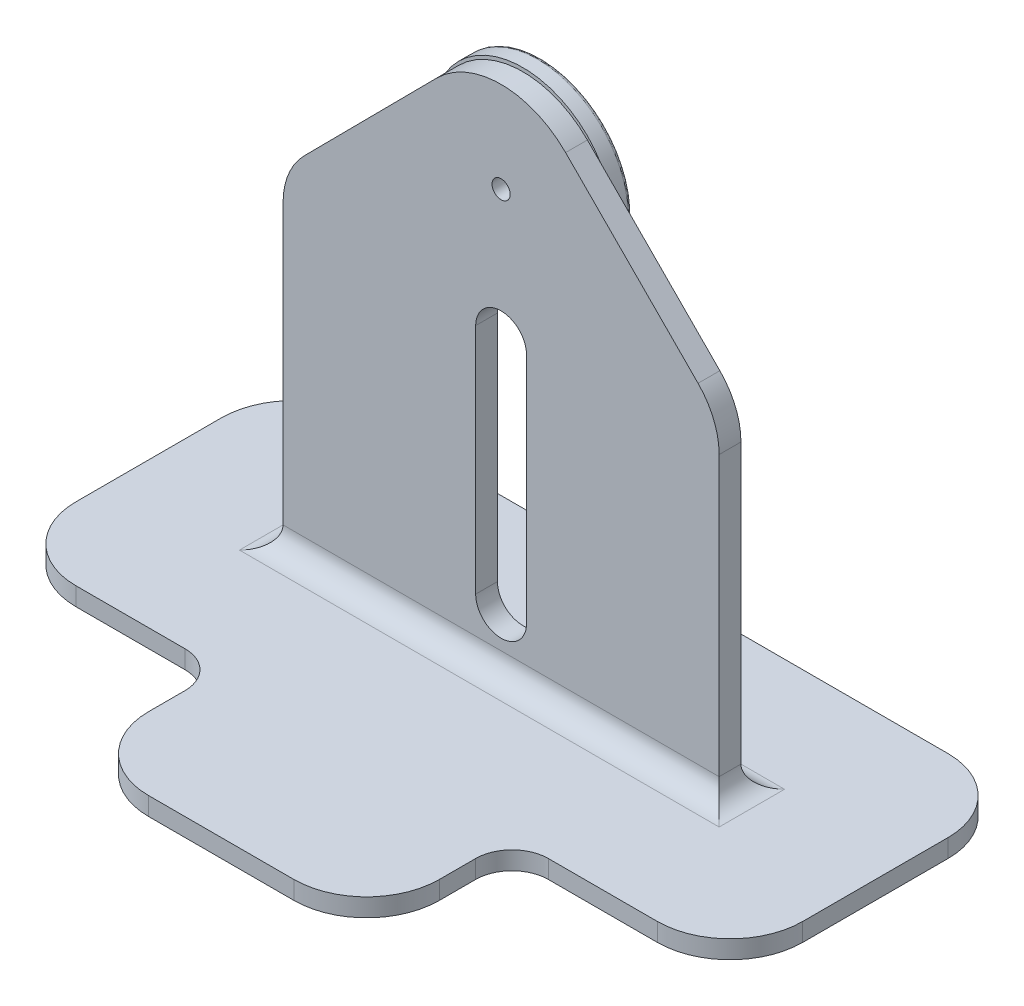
SolidWorks part; units mm, degrees
ref_plane "Plan de face" through (0, 0, 0) normal (0, 0, 1) x (1, 0, 0)
ref_plane "Plan de dessus" through (0, 0, 0) normal (0, 1, 0) x (1, 0, 0)
ref_plane "Plan de droite" through (0, 0, 0) normal (1, 0, 0) x (0, 0, -1)
sketch "Esquisse1" plane through (0, 0, 0) normal (0, 1, 0) x (1, 0, 0)
  line L0 (60, 40) -> (60, 0) construction
  line L1 (85, 0) -> (100, 0)
  line L2 (10, 10) -> (10, 30)
  line L3 (110, 20) -> (10, 20) construction
  line L4 (110, 10) -> (110, 30)
  line L5 (35, 0) -> (20, 0)
  line L7 (40, -5) -> (40, -10)
  line L8 (50, -20) -> (70, -20)
  line L9 (80, -5) -> (80, -10)
  line L10 (20, 40) -> (100, 40)
  arc A0 (20, 40) -> (10, 30) centre (20, 30) ccw
  arc A1 (110, 30) -> (100, 40) centre (100, 30) ccw
  arc A2 (100, 0) -> (110, 10) centre (100, 10) ccw
  arc A3 (20, 0) -> (10, 10) centre (20, 10) cw
  arc A4 (50, -20) -> (40, -10) centre (50, -10) cw
  arc A5 (70, -20) -> (80, -10) centre (70, -10) ccw
  arc A10 (80, -5) -> (85, 0) centre (85, -5) cw
  arc A11 (40, -5) -> (35, 0) centre (35, -5) ccw
  point P7 (0, 40)
  point P15 (0, 0)
  point P24 (40, -20)
  point P27 (80, -20)
  point P47 (80, 0)
  point P50 (40, 0)
  dimension "D3" = 10
  dimension "D7" = 10
  dimension "D1" = 100
  dimension "D2" = 40
  dimension "D4" = 20
  dimension "D5" = 40
  dimension "D6" = 20
  dimension "D8" = 50
extrude "Extrusion1" add sketch "Esquisse1" along normal blind 2.5
sketch "Esquisse2" plane through (0, 2.5, 0) normal (0, 1, 0) x (-1, 0, 0)
  line L0 (-110, -20) -> (-10, -20) construction
  line L1 (-110, -10) -> (-110, -30) construction
  line L2 (-10, -30) -> (-10, -10) construction
  line L4 (-90, -21.5) -> (-30, -21.5)
  line L5 (-90, -21.5) -> (-90, -18.5)
  line L6 (-90, -18.5) -> (-30, -18.5)
  line L7 (-30, -21.5) -> (-30, -18.5)
  dimension "D1" = 1.5
  dimension "D2" = 3
  dimension "D3" = 60
  dimension "D4" = 20
extrude "Extrusion2" add sketch "Esquisse2" along normal blind 75
sketch "Esquisse3" plane through (0, 0, -18.5) normal (0, 0, 1) x (1, 0, 0)
  line L0 (60, 2.5) -> (60, 70.8982) construction
  line L3 (50, 2.5) -> (70, 2.5) construction
  circle A0 centre (60, 60.5) radius 1.25
  dimension "D1" = 58
  dimension "D2" = 2.5
extrude "Enlèv. mat.-Extru.1" cut sketch "Esquisse3" against normal through all
sketch "Esquisse4" plane through (0, 0, -18.5) normal (0, 0, 1) x (1, 0, 0)
  line L0 (68.8757, 69.3018) -> (90, 48)
  line L1 (90, 77.5) -> (90, 2.5) construction
  line L2 (60, 60.5) -> (60, 37.4612) construction
  line L3 (51.1243, 69.3018) -> (30, 48)
  line L4 (90, 48) -> (118.5212, 48)
  line L5 (118.5212, 48) -> (110.2788, 86.4212)
  line L6 (110.2788, 86.4212) -> (5.7648, 83.2891)
  line L7 (5.7648, 83.2891) -> (30, 48)
  line L9 (56.5, 42.5) -> (56.5, 10.5)
  line L10 (63.5, 42.5) -> (63.5, 10.5)
  line L12 (50, 2.5) -> (70, 2.5) construction
  line L13 (50, 2.5) -> (40, 2.5) construction
  arc A0 (56.5, 42.5) -> (63.5, 42.5) centre (60, 42.5) cw
  arc A1 (51.1243, 69.3018) -> (68.8757, 69.3018) centre (60, 60.5) cw
  arc A2 (56.5, 10.5) -> (63.5, 10.5) centre (60, 10.5) ccw
  dimension "D4" = 12.5
  dimension "D1" = 8
  dimension "D2" = 40
  dimension "D3" = 3.5
extrude "Enlèv. mat.-Extru.2" cut sketch "Esquisse4" against normal through all
fillet "Congé2" radius 10 2 edges at (90, 48, -20) (30, 48, -20)
ref_plane "Plan1" through (60, 0, 0) normal (1, 0, 0) x (0, 0, -1)
sketch "Esquisse5" plane through (0, 0, -21.5) normal (0, 0, -1) x (-1, 0, 0)
  circle A0 centre (-60, 61) radius 1.5
  circle A1 centre (-60, 61) radius 12.5
  dimension "D1" = 25
extrude "Extrusion3" add sketch "Esquisse5" along normal blind 2.5
fillet "Congé3" radius 0.5 1 edges at (47.5, 61, -24)
fillet "Congé4" radius 3 4 edges at (90, 2.5, -20) (60, 2.5, -21.5) (30, 2.5, -20) (60, 2.5, -18.5)
